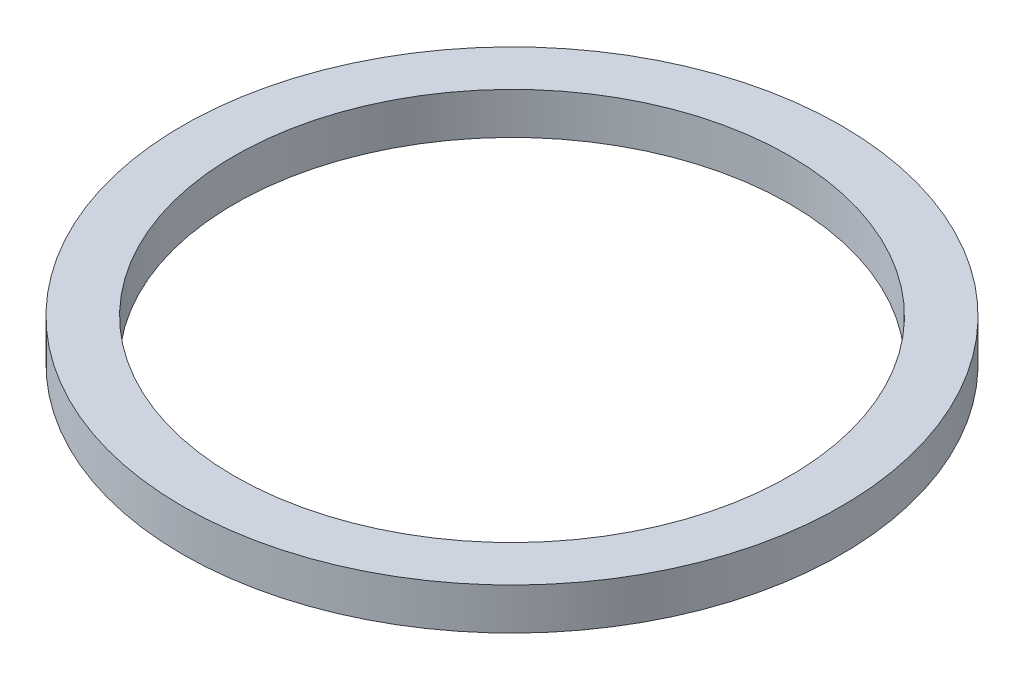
SolidWorks part; units mm, degrees
ref_plane "Face" through (0, 0, 0) normal (0, 0, 1) x (1, 0, 0)
ref_plane "Dessus" through (0, 0, 0) normal (0, 1, 0) x (1, 0, 0)
ref_plane "Droite" through (0, 0, 0) normal (1, 0, 0) x (0, 0, -1)
sketch "Esquisse1" plane through (0, 0, 0) normal (0, 1, 0) x (1, 0, 0)
  circle A0 centre (0, 0) radius 47.5
  circle A1 centre (0, 0) radius 40
  dimension "D1" = 95
  dimension "D2" = 80
extrude "Extrusion1" add sketch "Esquisse1" along normal blind 6
sketch "Esquisse2" plane through (0, 6, 0) normal (0, 1, 0) x (1, 0, 0)
  line L1 (-51.824, -50.8701) -> (60.9382, -50.8701)
  line L2 (-51.824, -50.8701) -> (-51.824, 0)
  line L3 (-51.824, 0) -> (60.9382, 0)
  line L4 (60.9382, -50.8701) -> (60.9382, 0)
extrude "Enlèv. mat.-Extru.1" [suppressed] cut sketch "Esquisse2" against normal through all
